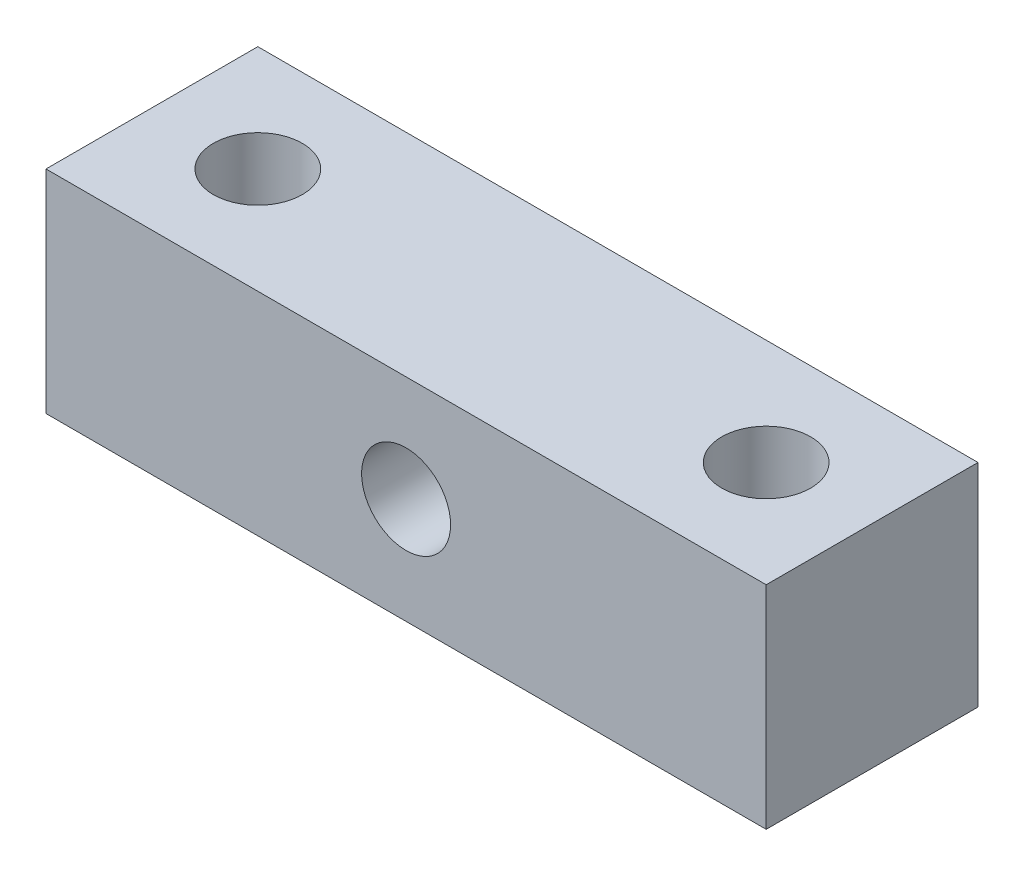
SolidWorks part; units mm, degrees
ref_plane "Front Plane" through (0, 0, 0) normal (0, 0, 1) x (1, 0, 0)
ref_plane "Top Plane" through (0, 0, 0) normal (0, 1, 0) x (1, 0, 0)
ref_plane "Right Plane" through (0, 0, 0) normal (1, 0, 0) x (0, 0, -1)
sketch "Sketch1" plane through (0, 0, 0) normal (0, 1, 0) x (1, 0, 0)
  line L1 (0, 0) -> (34, 0)
  line L2 (0, 0) -> (0, 10)
  line L3 (0, 10) -> (34, 10)
  line L4 (34, 0) -> (34, 10)
  dimension "D1" = 34
  dimension "D2" = 10
extrude "Extrude1" add sketch "Sketch1" along normal blind 10
sketch "Sketch2" plane through (0, 10, 0) normal (0, 1, 0) x (1, 0, 0)
  line L0 (0, 5) -> (34, 5) construction
  line L1 (0, 10) -> (0, 0) construction
  line L2 (34, 0) -> (34, 10) construction
  point P6 (5, 5)
  point P7 (29, 5)
  dimension "D1" = 5
  dimension "D2" = 5
sketch "Sketch4" plane through (0, 0, 0) normal (0, 0, 1) x (1, 0, 0)
  line L0 (0, 5) -> (34, 5) construction
  line L1 (0, 10) -> (0, 0) construction
  line L2 (34, 10) -> (34, 0) construction
  point P6 (17, 5)
hole_wizard "M5 Tapped Hole1" positions "3DSketch1" profile "Sketch5" tap size "M5" standard "ISO"
sketch3d "3DSketch1"
  point P0 (5, 10, -5)
  point P3 (29, 10, -5)
  point P6 (17, 5, 0)
sketch "Sketch5" plane through (5, 10, -5) normal (1, 0, 0) x (0, 0, 1)
  line L0 (0, 0) -> (0, 10)
  line L1 (0, 10) -> (2.1, 10)
  line L2 (2.1, 10) -> (2.1, 0)
  line L5 (2.1, 0) -> (0, 0)
  line L11 (0, -6.35) -> (0, 107.95) construction
  dimension "Thru Tap Drill Dia." = 4.2
  dimension "Thru Tap Drill Depth" = 10
